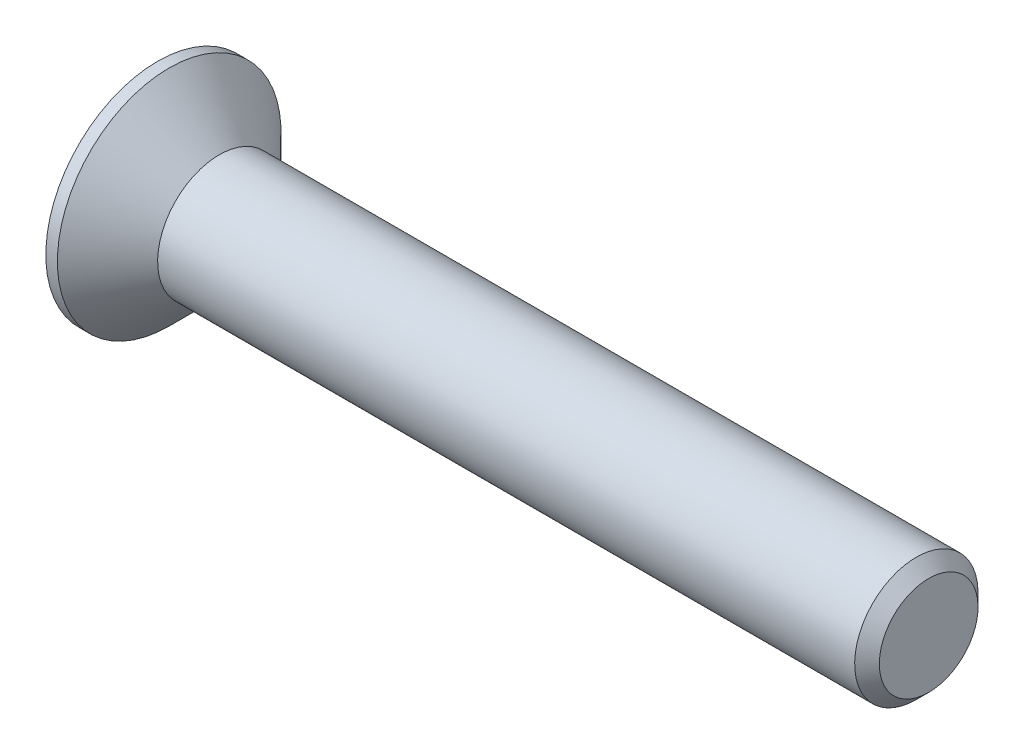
SolidWorks part; units mm, degrees
ref_plane "Front Plane" through (0, 0, 0) normal (0, 0, 1) x (1, 0, 0)
ref_plane "Top Plane" through (0, 0, 0) normal (0, 1, 0) x (1, 0, 0)
ref_plane "Right Plane" through (0, 0, 0) normal (1, 0, 0) x (0, 0, -1)
sketch "Sketch1" plane through (0, 0, 0) normal (0, 0, 1) x (1, 0, 0)
  line L1 (-4, 7.25) -> (-4, 0)
  line L2 (-4, 0) -> (46, 0)
  line L3 (46, 0) -> (46, 4)
  line L4 (46, 4) -> (0, 4)
  line L5 (-4, 7.25) -> (-3.25, 7.25)
  line L6 (-3.25, 7.25) -> (0, 4)
  dimension "D1" = 4
  dimension "D2" = 45
  dimension "D3" = 4
  dimension "D4" = 50
  dimension "D5" = 7.25
revolve "Revolve1" add sketch "Sketch1" angle 360 about L2
chamfer "Chamfer1" distance 0.8 angle 45 1 edges at (46, -4, 0)
sketch "Sketch2" plane through (-4, 0, 0) normal (-1, 0, 0) x (0, 0, 1)
  line L0 (-1.09, 4.35) -> (1.09, 4.35)
  line L1 (1.09, 4.35) -> (1.09, 1.09)
  line L2 (1.09, 1.09) -> (4.35, 1.09)
  line L3 (4.35, 1.09) -> (4.35, -1.09)
  line L4 (4.35, -1.09) -> (1.09, -1.09)
  line L5 (1.09, -1.09) -> (1.09, -4.35)
  line L6 (1.09, -4.35) -> (-1.09, -4.35)
  line L7 (-1.09, -4.35) -> (-1.09, -1.09)
  line L8 (-1.09, -1.09) -> (-4.35, -1.09)
  line L9 (-4.35, -1.09) -> (-4.35, 1.09)
  line L10 (-4.35, 1.09) -> (-1.09, 1.09)
  line L11 (-1.09, 1.09) -> (-1.09, 4.35)
  point P2 (0, 4.35)
  point P14 (0, -4.35)
  point P15 (4.35, 0)
  point P16 (-4.35, 0)
  dimension "D1" = 8.7
  dimension "D2" = 2.18
extrude "Cut-Extrude1" cut sketch "Sketch2" against normal blind 3.45
